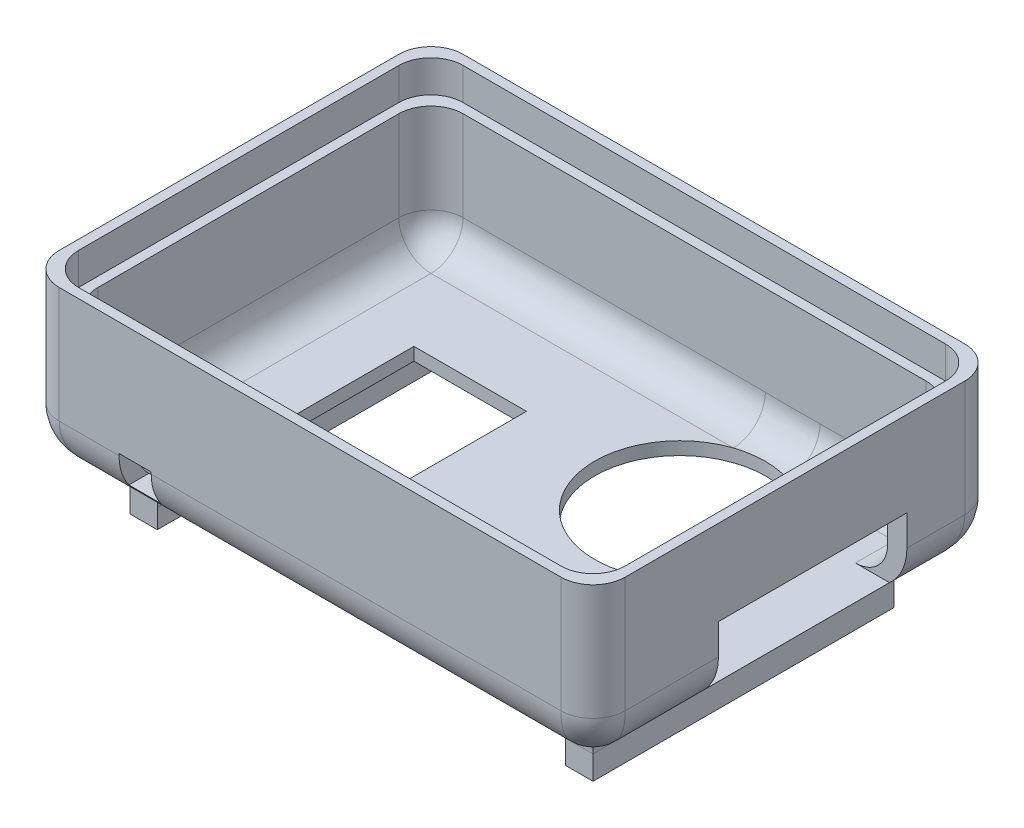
SolidWorks part; units mm, degrees
ref_plane "Front Plane" through (0, 0, 0) normal (0, 0, 1) x (1, 0, 0)
ref_plane "Top Plane" through (0, 0, 0) normal (0, 1, 0) x (1, 0, 0)
ref_plane "Right Plane" through (0, 0, 0) normal (1, 0, 0) x (0, 0, -1)
sketch "Sketch1" plane through (0, 0, 0) normal (0, 1, 0) x (1, 0, 0)
  line L1 (34.232, -28) -> (-47.768, -28)
  line L2 (34.232, -28) -> (34.232, 28.798)
  line L3 (34.232, 28.798) -> (-48.768, 28.798)
  line L4 (-47.768, -28) -> (-47.768, 28.798)
  line L5 (-50.768, -31) -> (37.232, -31)
  line L6 (-50.768, -31) -> (-50.768, 31.798)
  line L7 (-50.768, 31.798) -> (37.232, 31.798)
  line L8 (37.232, -31) -> (37.232, 31.798)
  line L13 (-50.768, 31.798) -> (37.232, 31.798)
  line L14 (-50.768, 31.798) -> (-50.768, -31)
  line L15 (-50.768, -31) -> (37.232, -31)
  line L16 (37.232, 31.798) -> (37.232, -31)
  line L17 (-47.768, 28.798) -> (34.232, 28.798)
  line L18 (-47.768, 28.798) -> (-47.768, -28)
  line L19 (-47.768, -28) -> (34.232, -28)
  line L20 (34.232, 28.798) -> (34.232, -28)
  line L21 (-16.768, -23) -> (-34.268, -23)
  line L22 (-34.268, 12.648) -> (-34.268, -23)
  line L23 (-16.768, 12.648) -> (-34.268, 12.648)
  line L24 (-16.768, 12.648) -> (-16.768, -23)
  circle A2 centre (8.481, 11.249) radius 13.249
  point P0 (0, 0)
  point P6 (0, 0)
  point P11 (9.882, 11.072)
  dimension "D1" = 82
  dimension "D2" = 3
  dimension "D3" = 3
  dimension "D4" = 3
  dimension "D5" = 3
extrude "Boss-Extrude6" add sketch "Sketch1" along normal blind 2
sketch "Sketch3" plane through (0, 0, 0) normal (0, 1, 0) x (1, 0, 0)
  line L1 (-50.768, 31.798) -> (37.232, 31.798)
  line L2 (-50.768, 31.798) -> (-50.768, -31)
  line L3 (-50.768, -31) -> (37.232, -31)
  line L4 (37.232, 31.798) -> (37.232, -31)
  line L5 (-47.768, 28.798) -> (34.232, 28.798)
  line L6 (-47.768, 28.798) -> (-47.768, -28)
  line L7 (-47.768, -28) -> (34.232, -28)
  line L8 (34.232, 28.798) -> (34.232, -28)
  dimension "D1" = 3
  dimension "D2" = 3
  dimension "D3" = 3
  dimension "D4" = 3
extrude "Boss-Extrude7" add sketch "Sketch3" along normal blind 26
sketch "Sketch5" plane through (0, 0, 31) normal (0, 0, 1) x (1, 0, 0)
  line L9 (-31.468, 8.3) -> (-36.468, 8.3)
  line L10 (-31.468, 8.3) -> (-31.468, 3.3)
  line L11 (-31.468, 3.3) -> (-36.468, 3.3)
  line L12 (-36.468, 8.3) -> (-36.468, 3.3)
extrude "Cut-Extrude1" cut sketch "Sketch5" against normal blind 26
sketch "Sketch11" plane through (-50.768, 0, 0) normal (-1, 0, 0) x (0, 0, 1)
  line L0 (31, 13) -> (29, 13)
  line L1 (31, 26) -> (31, 0) construction
  line L2 (-31.798, 13) -> (-29.798, 13)
  line L3 (-31.798, 26) -> (-31.798, 0) construction
  line L4 (-31.798, 0) -> (31, 0) construction
  line L5 (-17.798, 12.7599) -> (11.5, 12.7599)
  line L6 (-17.798, 12.7599) -> (-17.798, 2)
  line L7 (-17.798, 2) -> (11.5, 2)
  line L8 (11.5, 12.7599) -> (11.5, 2)
  line L10 (11.5, 12.7599) -> (-17.798, 12.7599)
  line L11 (11.5, 12.7599) -> (11.5, 2)
  line L12 (11.5, 2) -> (-17.798, 2)
  line L13 (-17.798, 12.7599) -> (-17.798, 2)
  dimension "D1" = 2
  dimension "D2" = 2
  dimension "D3" = 2
  dimension "D4" = 17.5
  dimension "D5" = 12
sketch "Sketch14" plane through (37.232, 0, 0) normal (1, 0, 0) x (0, 0, -1)
  line L1 (-11.5, 12.7599) -> (17.798, 12.7599)
  line L2 (-11.5, 12.7599) -> (-11.5, 2)
  line L3 (-11.5, 2) -> (17.798, 2)
  line L4 (17.798, 12.7599) -> (17.798, 2)
extrude "Cut-Extrude5" cut sketch "Sketch14" against normal blind 10
sketch "Sketch16" plane through (0, 26, 0) normal (0, 1, 0) x (1, 0, 0)
  line L0 (34.232, -28) -> (34.232, 28.798) construction
  line L1 (-49.268, 30.298) -> (35.732, 30.298)
  line L2 (-49.268, 30.298) -> (-49.268, -29.5)
  line L3 (-49.268, -29.5) -> (35.732, -29.5)
  line L4 (35.732, 30.298) -> (35.732, -29.5)
  line L5 (34.232, -28) -> (-47.768, -28) construction
  line L6 (-50.768, -11.5) -> (-50.768, 17.798) construction
  line L7 (37.232, 31.798) -> (-50.768, 31.798) construction
  dimension "D1" = 1.5
  dimension "D2" = 1.5
  dimension "D3" = 1.5
  dimension "D4" = 1.5
extrude "Cut-Extrude6" cut sketch "Sketch16" against normal blind 5
fillet "Fillet1" radius 5 4 edges at (-50.768, 13, 31) (37.232, 13, 31) (37.232, 13, -31.798) (-50.768, 13, -31.798)
fillet "Fillet3" radius 5 2 edges at (-47.768, 11.5, 28) (-49.268, 23.5, 29.5)
fillet "Fillet4" radius 5 2 edges at (-49.268, 23.5, -30.298) (-47.768, 11.5, -28.798)
fillet "Fillet5" radius 5 2 edges at (35.732, 23.5, -30.298) (34.232, 11.5, -28.798)
fillet "Fillet6" radius 5 2 edges at (35.732, 23.5, 29.5) (34.232, 11.5, 28)
fillet "Fillet8" radius 8 8 edges at (-49.3035, 0, -30.3335) (-50.768, 0, -0.399) (-49.3035, 0, 29.5355) (-6.768, 0, 31) (35.7675, 0, 29.5355) (37.232, 0, -0.399) (35.7675, 0, -30.3335) (-6.768, 0, -31.798)
fillet "Fillet9" radius 5 9 edges at (34.232, 2, 17.25) (-46.3035, 2, -27.3335) (-47.768, 2, -0.399) (-46.3035, 2, 26.5355) (-6.768, 2, -28.798) (32.7675, 2, -27.3335) (34.232, 2, -20.798) (32.7675, 2, 26.5355) (-6.768, 2, 28)
sketch "Sketch17" plane through (0, 0, 0) normal (0, -1, 0) x (1, 0, 0)
  line L0 (-34.268, 23) -> (-42.768, 23) construction
  line L1 (-42.768, -23.798) -> (-38.518, -23.798)
  line L2 (-42.768, -23.798) -> (-42.768, 23)
  line L3 (-42.768, 23) -> (-38.518, 23)
  line L4 (-38.518, -23.798) -> (-38.518, 23)
  line L5 (29.232, 23) -> (-16.768, 23) construction
  line L6 (29.232, -23.798) -> (24.982, -23.798)
  line L7 (29.232, -23.798) -> (29.232, 23)
  line L8 (29.232, 23) -> (24.982, 23)
  line L9 (24.982, -23.798) -> (24.982, 23)
  dimension "D1" = 4.25
  dimension "D2" = 4.25
extrude "Boss-Extrude8" add sketch "Sketch17" along normal blind 7
fillet "Fillet10" radius 4 8 edges at (27.107, 0, 23) (27.107, 0, -23.798) (29.232, 0, -0.399) (24.982, 0, -0.399) (-40.643, 0, -23.798) (-42.768, 0, -0.399) (-40.643, 0, 23) (-38.518, 0, -0.399)
